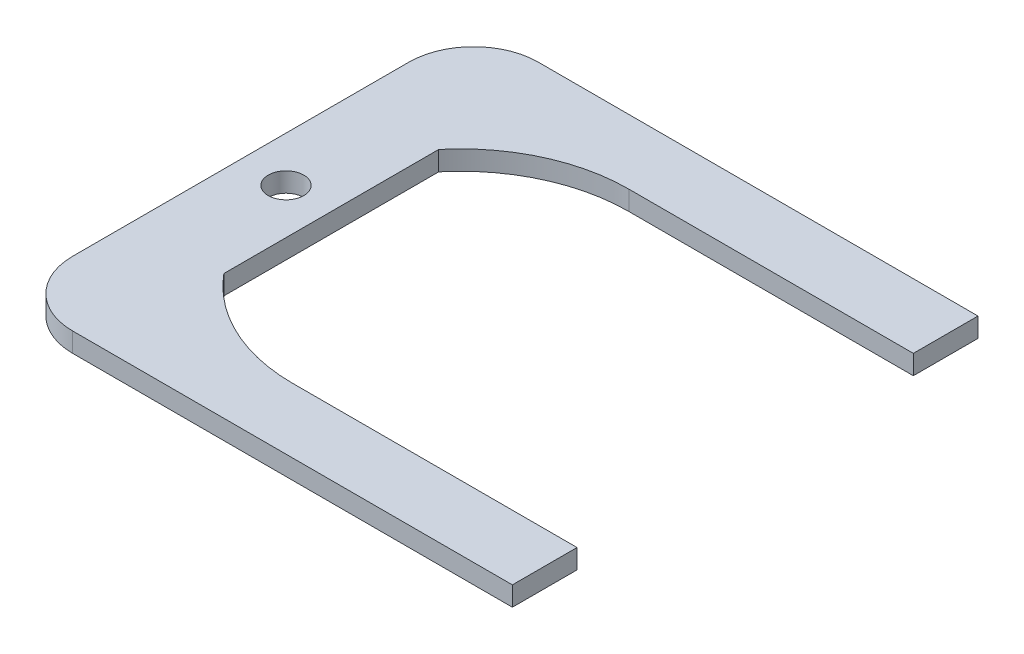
SolidWorks part; units mm, degrees
ref_plane "Front Plane" through (0, 0, 0) normal (0, 0, 1) x (1, 0, 0)
ref_plane "Top Plane" through (0, 0, 0) normal (0, 1, 0) x (1, 0, 0)
ref_plane "Right Plane" through (0, 0, 0) normal (1, 0, 0) x (0, 0, -1)
sketch "Sketch1" plane through (0, 0, 0) normal (0, 1, 0) x (1, 0, 0)
  line L0 (-7, 0) -> (88.9505, 0) construction
  line L1 (-7, -26) -> (-7, 26)
  line L2 (3, 36) -> (71, 36)
  line L3 (7, 16.6132) -> (7, -16.6132)
  line L4 (71, 36) -> (71, 26)
  line L5 (71, 26) -> (27, 26)
  line L6 (71, -26) -> (27, -26)
  line L7 (71, -36) -> (71, -26)
  line L8 (3, -36) -> (71, -36)
  circle A0 centre (0, 0) radius 2.75
  arc A1 (-7, 26) -> (3, 36) centre (3, 26) cw
  arc A2 (27, -26) -> (7, -16.6132) centre (27, 0) cw
  arc A3 (27, 26) -> (7, 16.6132) centre (27, 0) ccw
  arc A4 (-7, -26) -> (3, -36) centre (3, -26) ccw
  point P12 (-7, 36)
  point P14 (7, 0)
  dimension "D3" = 7
  dimension "D6" = 10
  dimension "D1" = 36
  dimension "D7" = 5.5
  dimension "D8" = 26
  dimension "D9" = 44
  dimension "D2" = 7
  dimension "D4" = 10
  dimension "D5" = 78
extrude "Extrude1" add sketch "Sketch1" along normal blind 3
